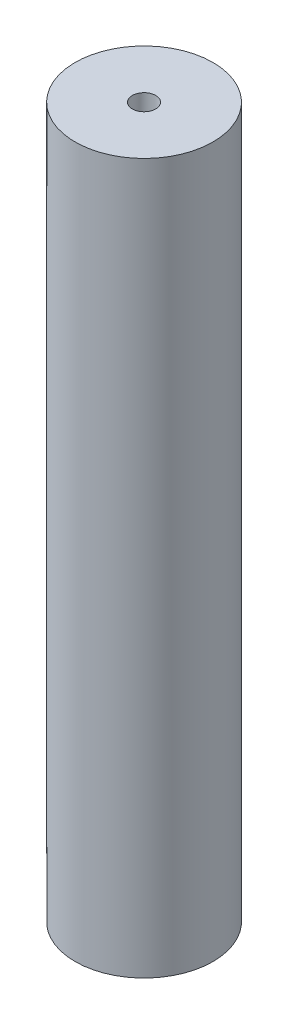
SolidWorks part; units mm, degrees
ref_plane "Front Plane" through (0, 0, 0) normal (0, 0, 1) x (1, 0, 0)
ref_plane "Top Plane" through (0, 0, 0) normal (0, 1, 0) x (1, 0, 0)
ref_plane "Right Plane" through (0, 0, 0) normal (1, 0, 0) x (0, 0, -1)
body saved out of another part "Stock-V1-1"
other "Move Face1" parameters "D1"=1
